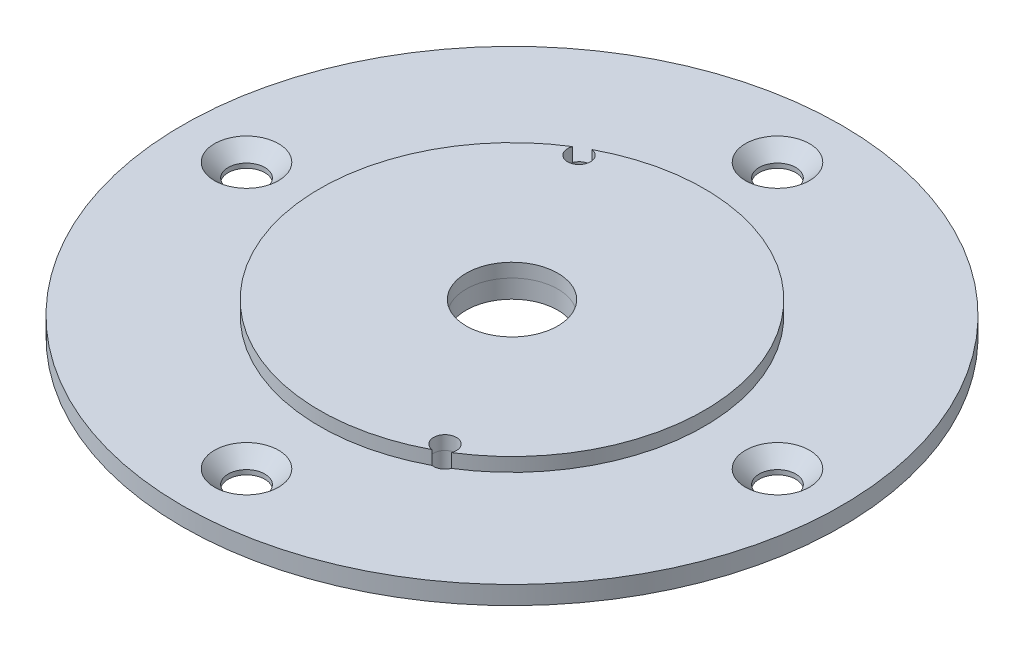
SolidWorks part; units mm, degrees
ref_plane "Plan de face" through (0, 0, 0) normal (0, 0, 1) x (1, 0, 0)
ref_plane "Plan de dessus" through (0, 0, 0) normal (0, 1, 0) x (1, 0, 0)
ref_plane "Plan de coté" through (0, 0, 0) normal (1, 0, 0) x (0, 0, -1)
sketch "Esquisse1" plane through (0, 0, 0) normal (0, 1, 0) x (1, 0, 0)
  circle A0 centre (0, 0) radius 36
  circle A1 centre (0, 0) radius 5
  dimension "D1" = 72
  dimension "D2" = 10
extrude "Boss.-Extru.1" add sketch "Esquisse1" along normal mid plane 2
hole_wizard "Fraisage pour vis à tête fraisée M41" positions "Esquisse3" profile "Esquisse2" countersink size "M4" standard "ISO"
sketch "Esquisse3" plane through (0, 1, 0) normal (0, 1, 0) x (1, 0, 0)
  line L0 (0, 0) -> (0, 11.6521) construction
  line L2 (0, 0) -> (10.5778, 0) construction
  point P0 (-29, 0)
  point P14 (29, 0)
  point P22 (0, 29)
  point P24 (0, -29)
  dimension "D1" = 58
  dimension "D2" = 58
sketch "Esquisse2" plane through (-29, 1, 0) normal (1, 0, 0) x (0, 0, 1)
  line L0 (0, 0) -> (0, 2)
  line L1 (0, 2) -> (2, 2)
  line L2 (2, 2) -> (2, 1.5)
  line L3 (2, 1.5) -> (3.5, 0)
  line L5 (3.5, 0) -> (0, 0)
  line L6 (-2, 1.5) -> (-3.5, 0) construction
  line L11 (0, -6.35) -> (0, 107.95) construction
  dimension "Diamètre du perçage jusqu'au prochain" = 4
  dimension "Profondeur du perçage jusqu'au prochain" = 2
  dimension "Diamètre du fraisage entrant" = 7
  dimension "Angle du fraisage entrant" = 90
hole_wizard "Trou taraudé M31" positions "Esquisse5" profile "Esquisse4" tap size "M3" standard "ISO"
sketch "Esquisse5" plane through (0, 1, 0) normal (0, 1, 0) x (1, 0, 0)
  line L0 (-10, 17.3205) -> (10, -17.3205) construction
  line L2 (0, 0) -> (0, 7.8205) construction
  point P0 (-10, 17.3205)
  point P1 (10, -17.3205)
  dimension "D1" = 40
  dimension "D2" = 30
sketch "Esquisse4" plane through (-10, 1, -17.3205) normal (1, 0, 0) x (0, 0, 1)
  line L0 (0, 0) -> (0, 2)
  line L1 (0, 2) -> (1.25, 2)
  line L2 (1.25, 2) -> (1.25, 0)
  line L5 (1.25, 0) -> (0, 0)
  line L11 (0, -6.35) -> (0, 107.95) construction
  dimension "Diamètre du trou pour taraudage jusqu'au prochain" = 2.5
  dimension "Profondeur du trou pour taraudage jusqu'au prochain" = 2
sketch "Esquisse6" plane through (0, 1, 0) normal (0, 1, 0) x (1, 0, 0)
  circle A0 centre (0, 0) radius 5 construction
  circle A1 centre (0, 0) radius 5
  arc A2 (-11.1584, 17.7902) -> (9.8275, -18.5586) centre (0, 0) ccw
  circle A3 centre (-10, 17.3205) radius 1.25 construction
  arc A4 (-11.1584, 17.7902) -> (-9.8275, 18.5586) centre (-10, 17.3205) ccw
  circle A5 centre (10, -17.3205) radius 1.25 construction
  arc A6 (11.1584, -17.7902) -> (9.8275, -18.5586) centre (10, -17.3205) ccw
  arc A7 (11.1584, -17.7902) -> (-9.8275, 18.5586) centre (0, 0) ccw
  dimension "D1" = 42
extrude "Boss.-Extru.2" add sketch "Esquisse6" along normal blind 1.5 separate body
